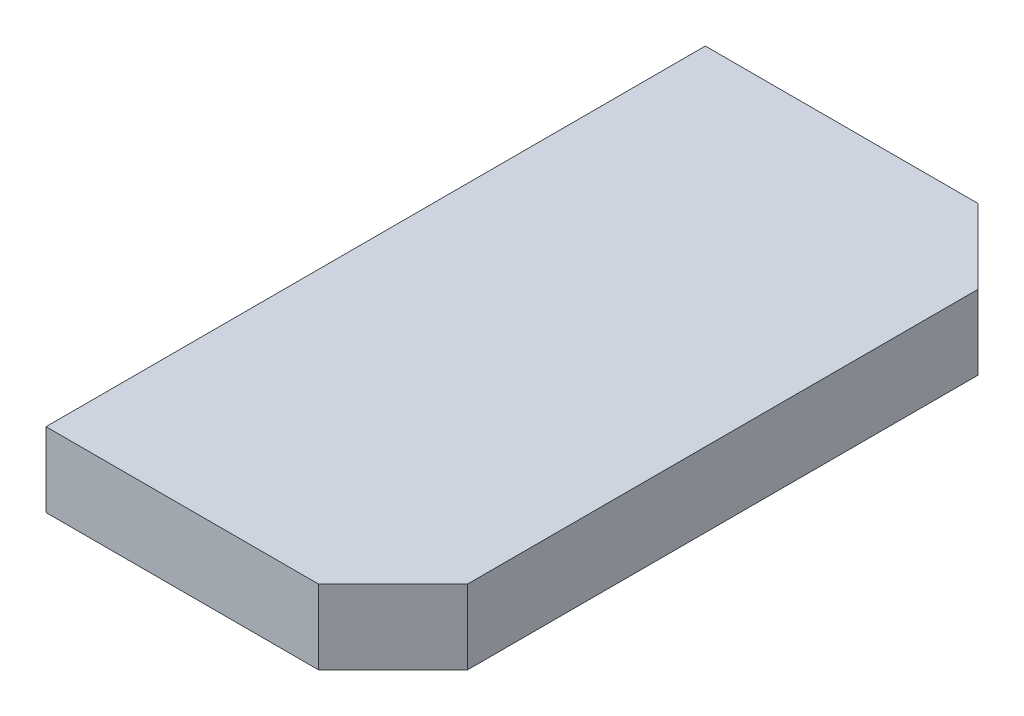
SolidWorks part; units mm, degrees
ref_plane "Plan de face" through (0, 0, 0) normal (0, 0, 1) x (1, 0, 0)
ref_plane "Plan de dessus" through (0, 0, 0) normal (0, 1, 0) x (1, 0, 0)
ref_plane "Plan de droite" through (0, 0, 0) normal (1, 0, 0) x (0, 0, -1)
sketch "Esquisse1" plane through (0, 0, 0) normal (0, 0, 1) x (1, 0, 0)
  line L1 (0, 0) -> (70, 0)
  line L2 (0, 0) -> (0, 15)
  line L3 (0, 15) -> (70, 15)
  line L4 (70, 0) -> (70, 15)
  dimension "D1" = 70
  dimension "D2" = 15
extrude "Extrusion1" add sketch "Esquisse1" along normal blind 133
chamfer "Chanfrein1" distance 15 angle 45 2 edges at (70, 7.5, 0) (70, 7.5, 133)
